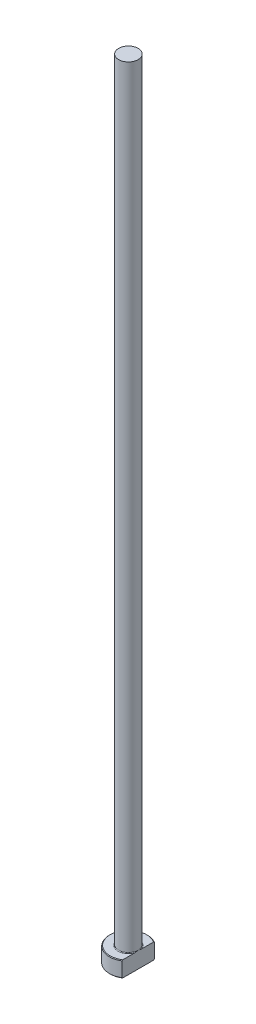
SolidWorks part; units mm, degrees
ref_plane "Front Plane" through (0, 0, 0) normal (0, 0, 1) x (1, 0, 0)
ref_plane "Top Plane" through (0, 0, 0) normal (0, 1, 0) x (1, 0, 0)
ref_plane "Right Plane" through (0, 0, 0) normal (1, 0, 0) x (0, 0, -1)
sketch "Sketch1" plane through (0, 0, 0) normal (0, 0, 1) x (1, 0, 0)
  line L0 (0, 259.9588) -> (0, -15.1925) construction
  line L1 (0, 0) -> (-6, 0)
  line L2 (-6, 0) -> (-6, 5)
  line L3 (-6, 5) -> (-3.1, 5)
  line L4 (-3.1, 5) -> (-3.1, 250)
  line L5 (-3.1, 250) -> (0, 250)
  line L6 (0, 250) -> (0, 0)
  dimension "L" = 250
  dimension "H" = 12
  dimension "T" = 5
  dimension "D" = 6.2
revolve "Revolve1" add sketch "Sketch1" angle 360 about L0
chamfer "Chamfer1" distance 0.2 angle 45 2 edges at (0, 5, 6) (0, 0, 6)
fillet "Fillet1" radius 0.2 1 edges at (0, 5, 3.1)
sketch "Sketch2" plane through (0, 0, 0) normal (0, 1, 0) x (1, 0, 0)
  line L0 (3.1, 5.1371) -> (3.1, -5.1371)
  circle A0 centre (0, 0) radius 6 construction
  arc A1 (3.1, -5.1371) -> (3.1, 5.1371) centre (0, 0) ccw
  circle A2 centre (0, 0) radius 3.1 construction
extrude "KEY" cut sketch "Sketch2" along normal through all
